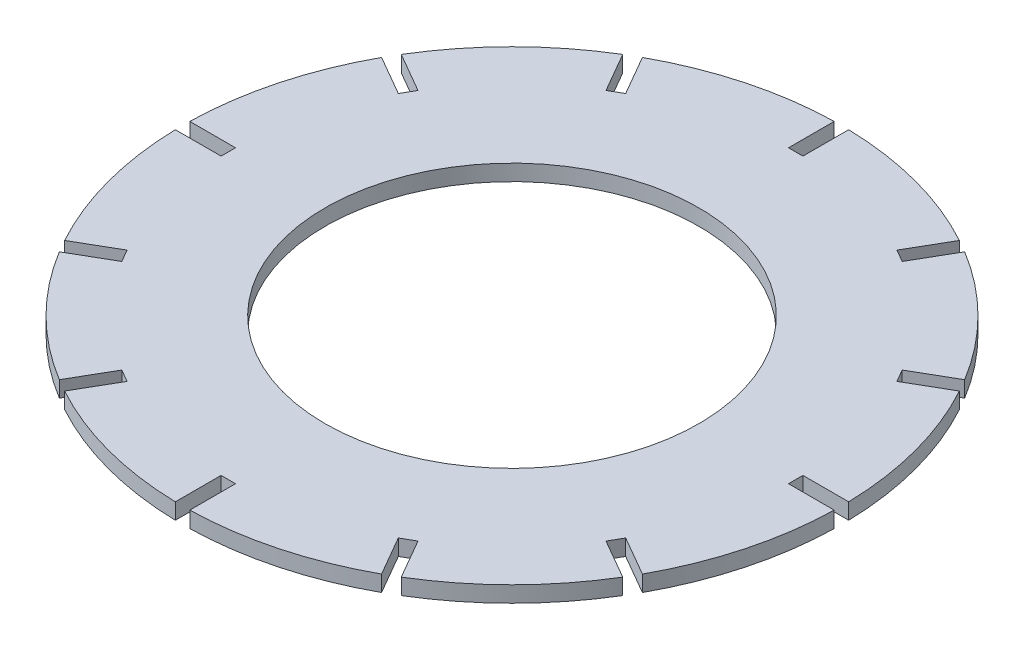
SolidWorks part; units mm, degrees
ref_plane "Front Plane" through (0, 0, 0) normal (0, 0, 1) x (1, 0, 0)
ref_plane "Top Plane" through (0, 0, 0) normal (0, 1, 0) x (1, 0, 0)
ref_plane "Right Plane" through (0, 0, 0) normal (1, 0, 0) x (0, 0, -1)
sketch "Sketch1" plane through (0, 0, 0) normal (0, 1, 0) x (1, 0, 0)
  line L0 (0, 53.1152) -> (0, -61.69) construction
  line L1 (45.3241, -27.7267) -> (52.7373, -32.0067)
  line L2 (61.69, 0) -> (-53.1152, 0) construction
  line L3 (53.1152, -1.35) -> (61.6752, -1.35)
  line L4 (53.1152, -1.35) -> (53.1152, 1.35)
  line L5 (53.1152, 1.35) -> (61.6752, 1.35)
  line L7 (53.1152, -1.35) -> (61.6752, 1.35) construction
  line L8 (53.1152, 1.35) -> (61.6752, -1.35) construction
  line L9 (45.3241, -27.7267) -> (46.6741, -25.3885)
  line L10 (46.6741, -25.3885) -> (54.0873, -29.6685)
  line L11 (25.3885, -46.6741) -> (29.6685, -54.0873)
  line L12 (25.3885, -46.6741) -> (27.7267, -45.3241)
  line L13 (27.7267, -45.3241) -> (32.0067, -52.7373)
  line L14 (-1.35, -53.1152) -> (-1.35, -61.6752)
  line L15 (-1.35, -53.1152) -> (1.35, -53.1152)
  line L16 (1.35, -53.1152) -> (1.35, -61.6752)
  line L17 (-27.7267, -45.3241) -> (-32.0067, -52.7373)
  line L18 (-27.7267, -45.3241) -> (-25.3885, -46.6741)
  line L19 (-25.3885, -46.6741) -> (-29.6685, -54.0873)
  line L20 (-46.6741, -25.3885) -> (-54.0873, -29.6685)
  line L21 (-46.6741, -25.3885) -> (-45.3241, -27.7267)
  line L22 (-45.3241, -27.7267) -> (-52.7373, -32.0067)
  line L23 (-53.1152, 1.35) -> (-61.6752, 1.35)
  line L24 (-53.1152, 1.35) -> (-53.1152, -1.35)
  line L25 (-53.1152, -1.35) -> (-61.6752, -1.35)
  line L26 (-45.3241, 27.7267) -> (-52.7373, 32.0067)
  line L27 (-45.3241, 27.7267) -> (-46.6741, 25.3885)
  line L28 (-46.6741, 25.3885) -> (-54.0873, 29.6685)
  line L29 (-25.3885, 46.6741) -> (-29.6685, 54.0873)
  line L30 (-25.3885, 46.6741) -> (-27.7267, 45.3241)
  line L31 (-27.7267, 45.3241) -> (-32.0067, 52.7373)
  line L32 (1.35, 53.1152) -> (1.35, 61.6752)
  line L33 (1.35, 53.1152) -> (-1.35, 53.1152)
  line L34 (-1.35, 53.1152) -> (-1.35, 61.6752)
  line L35 (27.7267, 45.3241) -> (32.0067, 52.7373)
  line L36 (27.7267, 45.3241) -> (25.3885, 46.6741)
  line L37 (25.3885, 46.6741) -> (29.6685, 54.0873)
  line L38 (46.6741, 25.3885) -> (54.0873, 29.6685)
  line L39 (46.6741, 25.3885) -> (45.3241, 27.7267)
  line L40 (45.3241, 27.7267) -> (52.7373, 32.0067)
  arc A0 (-52.7373, -32.0067) -> (-32.0067, -52.7373) centre (0, 0) ccw
  circle A2 centre (0, 0) radius 35
  arc A3 (-29.6685, -54.0873) -> (-1.35, -61.6752) centre (0, 0) ccw
  arc A4 (1.35, -61.6752) -> (29.6685, -54.0873) centre (0, 0) ccw
  arc A5 (32.0067, -52.7373) -> (52.7373, -32.0067) centre (0, 0) ccw
  arc A6 (54.0873, -29.6685) -> (61.6752, -1.35) centre (0, 0) ccw
  arc A7 (61.6752, 1.35) -> (54.0873, 29.6685) centre (0, 0) ccw
  arc A8 (52.7373, 32.0067) -> (32.0067, 52.7373) centre (0, 0) ccw
  arc A9 (29.6685, 54.0873) -> (1.35, 61.6752) centre (0, 0) ccw
  arc A10 (-1.35, 61.6752) -> (-29.6685, 54.0873) centre (0, 0) ccw
  arc A11 (-32.0067, 52.7373) -> (-52.7373, 32.0067) centre (0, 0) ccw
  arc A12 (-54.0873, 29.6685) -> (-61.6752, 1.35) centre (0, 0) ccw
  arc A13 (-61.6752, -1.35) -> (-54.0873, -29.6685) centre (0, 0) ccw
  point P5 (57.3952, 0)
  point P14 (53.1152, 0)
  point P60 (0, 0)
  dimension "D1" = 123.38
  dimension "D3" = 2.7
  dimension "D4" = 12
  dimension "D2" = 8.56
extrude "Boss-Extrude1" add sketch "Sketch1" along normal blind 3
